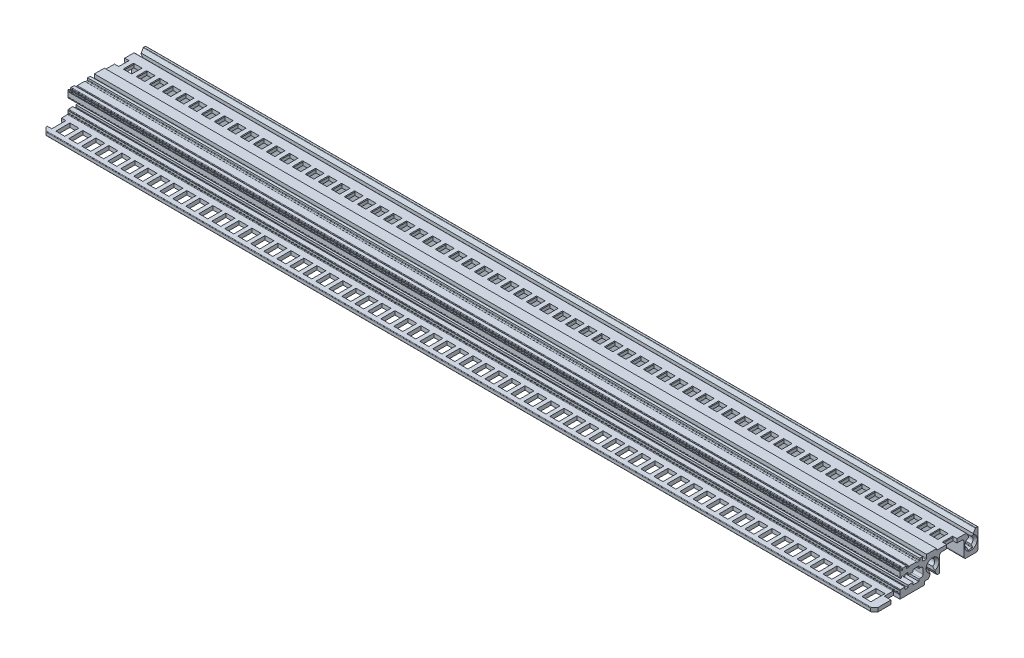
SolidWorks part; units mm, degrees
other "1"
ref_plane "前视基准面" through (0, 0, 0) normal (0, 0, 1) x (1, 0, 0)
ref_plane "上视基准面" through (0, 0, 0) normal (0, 1, 0) x (1, 0, 0)
ref_plane "右视基准面" through (0, 0, 0) normal (1, 0, 0) x (0, 0, -1)
imported_body "输入1"
sketch "草图1" plane through (0, 0, -10.25) normal (0, 0, -1) x (-1, 0, 0)
  line L0 (-215.9, -0.2) -> (-215.9, -7.6) construction
  line L1 (215.9, 11.0552) -> (109.22, 11.0552)
  line L2 (215.9, 11.0552) -> (215.9, -20.327)
  line L3 (215.9, -20.327) -> (109.22, -20.327)
  line L4 (109.22, 11.0552) -> (109.22, -20.327)
  line L5 (215.9, -0.2) -> (215.9, -7.6) construction
  dimension "D1" = 325.12
extrude "切除-拉伸1" cut sketch "草图1" against normal blind 48
sketch "草图2" plane through (0, -7.9, 0) normal (0, 1, 0) x (1, 0, 0)
  line L0 (-109.22, -28.75) -> (-107.72, -30.25)
  line L1 (-109.22, -30.25) -> (-107.72, -30.25)
  line L2 (-109.22, -30.25) -> (-109.22, -28.75)
  dimension "D1" = 1.5
  dimension "D2" = 1.5
extrude "切除-拉伸2" cut sketch "草图2" against normal through all
sketch "草图3" plane through (-109.22, 0, 0) normal (-1, 0, 0) x (0, 0, 1)
  circle A0 centre (-7.5, -4.2) radius 1.65
  circle A1 centre (7.5, -4.2) radius 1.65
extrude "切除-拉伸3" cut sketch "草图3" against normal blind 15.02
chamfer "倒角1" distance 0.85 angle 45 3 edges at (-109.22, -4.2, 5.85) (-109.22, -4.2, 9.15) (-109.22, -4.2, -9.15)
